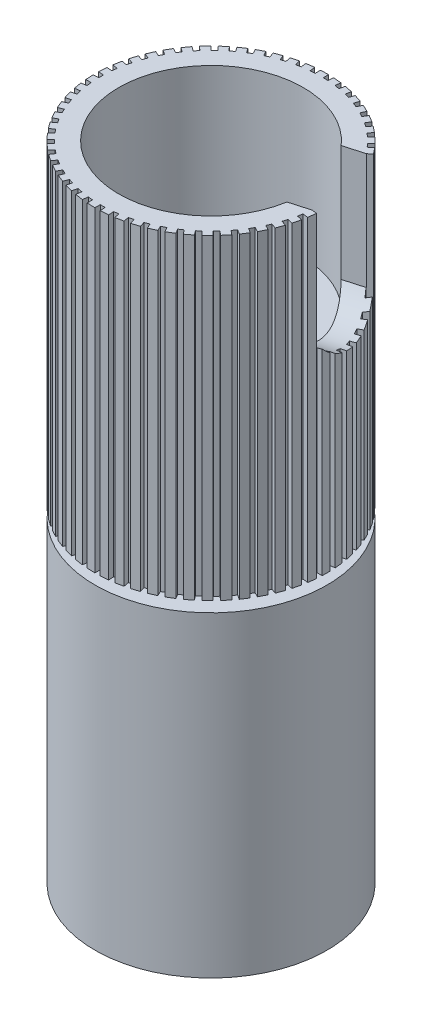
SolidWorks part; units mm, degrees
ref_plane "Alzado" through (0, 0, 0) normal (0, 0, 1) x (1, 0, 0)
ref_plane "Planta" through (0, 0, 0) normal (0, 1, 0) x (1, 0, 0)
ref_plane "Vista lateral" through (0, 0, 0) normal (1, 0, 0) x (0, 0, -1)
imported_body "CABEZAL-1-solid2"
imported_body "CABEZAL-1-solid3"
imported_body "CABEZAL-1-solid4"
sketch "Croquis1" plane through (0, -17.2252, 0) normal (0, 1, 0) x (1, 0, 0)
  circle A0 centre (14.1597, -138.6615) radius 17.5
extrude "Saliente-Extruir1" add sketch "Croquis1" along normal blind 22
